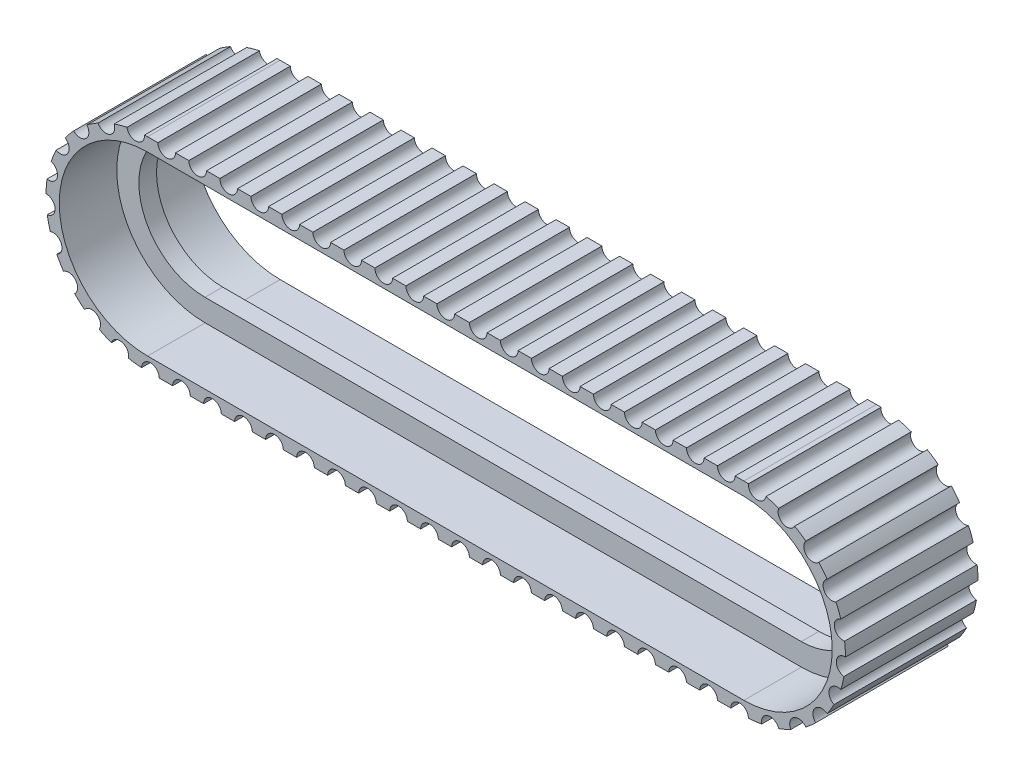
SolidWorks part; units mm, degrees
ref_plane "Front Plane" through (0, 0, 0) normal (0, 0, 1) x (1, 0, 0)
ref_plane "Top Plane" through (0, 0, 0) normal (0, 1, 0) x (1, 0, 0)
ref_plane "Right Plane" through (0, 0, 0) normal (1, 0, 0) x (0, 0, -1)
sketch "Sketch1" plane through (0, 0, 0) normal (0, 0, 1) x (1, 0, 0)
  line L0 (0, 0) -> (135, 0) construction
  line L1 (135, 20) -> (0, 20)
  line L2 (0, -20) -> (135, -20)
  line L3 (135, 23) -> (0, 23)
  line L4 (0, -23) -> (135, -23)
  arc A0 (0, 20) -> (0, -20) centre (0, 0) ccw
  arc A1 (135, -20) -> (135, 20) centre (135, 0) ccw
  arc A2 (0, 23) -> (0, -23) centre (0, 0) ccw
  arc A3 (135, -23) -> (135, 23) centre (135, 0) ccw
  dimension "D2" = 40
  dimension "D1" = 135
  dimension "D3" = 3
extrude "Extrude1" add sketch "Sketch1" along normal blind 30
sketch "Sketch2" plane through (0, 0, 30) normal (0, 0, 1) x (1, 0, 0)
  line L0 (135, 23) -> (0, 23) construction
  circle A0 centre (67.5, 23) radius 2
  dimension "D1" = 4
sketch "Sketch3" plane through (0, 0, 30) normal (0, 0, 1) x (1, 0, 0)
  line L0 (0, 23) -> (135, 23)
  line L1 (0, -23) -> (135, -23)
  arc A0 (135, -23) -> (135, 23) centre (135, 0) ccw
  arc A1 (0, 23) -> (0, -23) centre (0, 0) ccw
extrude "Extrude2" cut sketch "Sketch2" against normal through all
pattern_curve "CrvPattern1" of "Extrude2" parameters "D1"=59, "D3"=7.02, "D2"=1, "D4"=50
ref_plane "Plane1" through (0, 0, 15) normal (0, 0, 1) x (1, 0, 0)
sketch "Sketch4" plane through (0, 0, 15) normal (0, 0, 1) x (1, 0, 0)
  line L0 (135, 20) -> (0, 20)
  line L1 (0, -20) -> (135, -20)
  arc A0 (0, 20) -> (0, -20) centre (0, 0) ccw
  arc A1 (135, -20) -> (135, 20) centre (135, 0) ccw
ref_plane "Plane2" through (67.5, 0, 0) normal (1, 0, 0) x (0, 0, -1)
sketch "Sketch6" plane through (67.5, 0, 0) normal (1, 0, 0) x (0, 0, -1)
  line L0 (-15, 22.9768) -> (-15, -22.9772) construction
  line L1 (-30, 22.9768) -> (0, 22.9768) construction
  line L2 (-30, -22.9772) -> (0, -22.9772) construction
  line L3 (-30, -22.9772) -> (0, -22.9772) construction
  line L4 (-17, -19.9772) -> (-13, -19.9772)
  line L5 (-13, -19.9772) -> (-13, -14.9772)
  line L6 (-13, -14.9772) -> (-17, -14.9772)
  line L7 (-17, -14.9772) -> (-17, -19.9772)
  line L8 (-30, -19.9772) -> (0, -19.9772) construction
  dimension "D2" = 5
  dimension "D3" = 4
  dimension "D4" = 2
  dimension "D1" = 3
sweep "Sweep1" add profiles "Sketch6" path "Sketch4"
